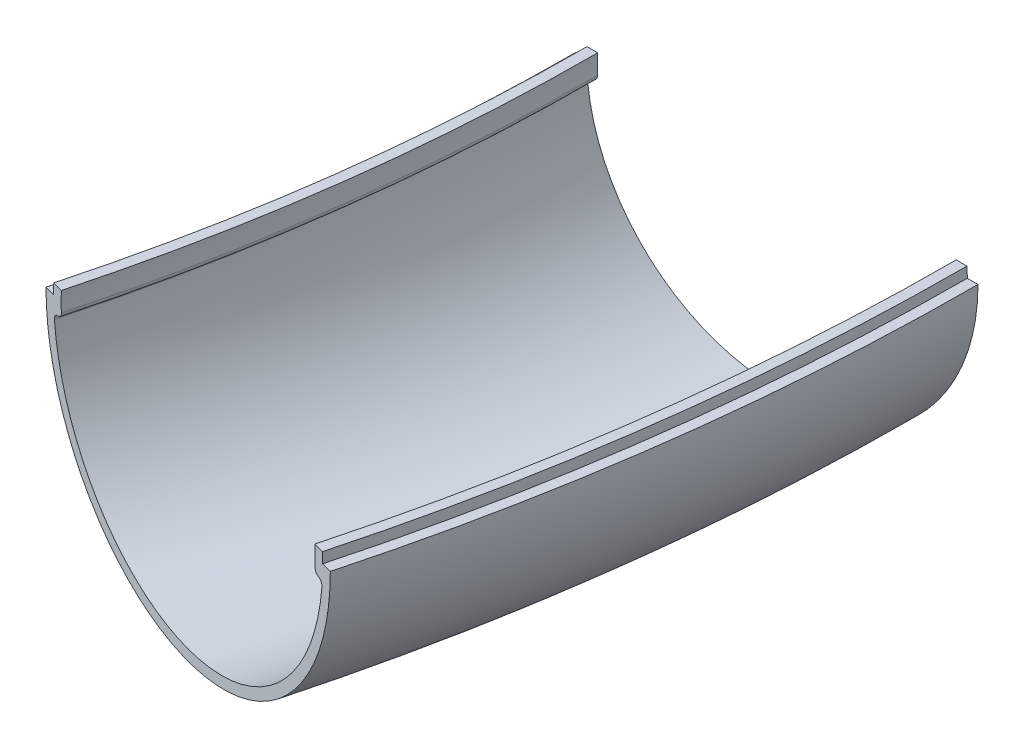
SolidWorks part; units mm, degrees
ref_plane "Спереди" through (0, 0, 0) normal (0, 0, 1) x (1, 0, 0)
ref_plane "Сверху" through (0, 0, 0) normal (0, 1, 0) x (1, 0, 0)
ref_plane "Справа" through (0, 0, 0) normal (1, 0, 0) x (0, 0, -1)
sketch "Эскиз1" plane through (0, 0, 0) normal (0, 0, 1) x (1, 0, 0)
  line L56 (135.8213, 0.7768) -> (136.6225, 0.7768)
  line L58 (135, 0) -> (135.8, 0)
  line L62 (164.2, 0) -> (165, 0)
  line L63 (163.3775, 0.7768) -> (164.1787, 0.7768)
  line L65 (0, 44.1102) -> (0, 0) construction
  line L75 (163.7822, -1.1006) -> (163.7182, -1.1006)
  line L89 (150, 5.3815) -> (150, -7.2871) construction
  line L90 (136.2178, -1.1006) -> (136.2818, -1.1006)
  arc A18 (135.8213, 0.7768) -> (135.8, 0) centre (150, 0) ccw
  arc A19 (164.2, 0) -> (164.1787, 0.7768) centre (150, 0) ccw
  arc A20 (136.6225, 0.7768) -> (136.6173, -0.6803) centre (150, 0) ccw
  arc A21 (163.3827, -0.6803) -> (163.3775, 0.7768) centre (150, 0) ccw
  arc A22 (164.2, 0) -> (164.1787, 0.7768) centre (150, 0) ccw
  arc A23 (135.8842, -1.5441) -> (164.1158, -1.5441) centre (150, 0) ccw
  arc A38 (135, 0) -> (165, 0) centre (150, 0) ccw
  arc A39 (135.8213, 0.7768) -> (135.8, 0) centre (150, 0) ccw
  arc A41 (136.6173, -0.6803) -> (136.2178, -1.1006) centre (136.2178, -0.7006) cw
  arc A42 (163.3827, -0.6803) -> (163.7822, -1.1006) centre (163.7822, -0.7006) ccw
  arc A43 (136.2818, -1.1006) -> (135.8842, -1.5441) centre (136.2818, -1.5006) ccw
  arc A44 (163.7182, -1.1006) -> (164.1158, -1.5441) centre (163.7182, -1.5006) cw
  point P16 (135.8427, -1.1006)
  dimension "D1" = 0.4
  dimension "D2" = 150
revolve "Повернуть1" add sketch "Эскиз1" angle 15 about L65
